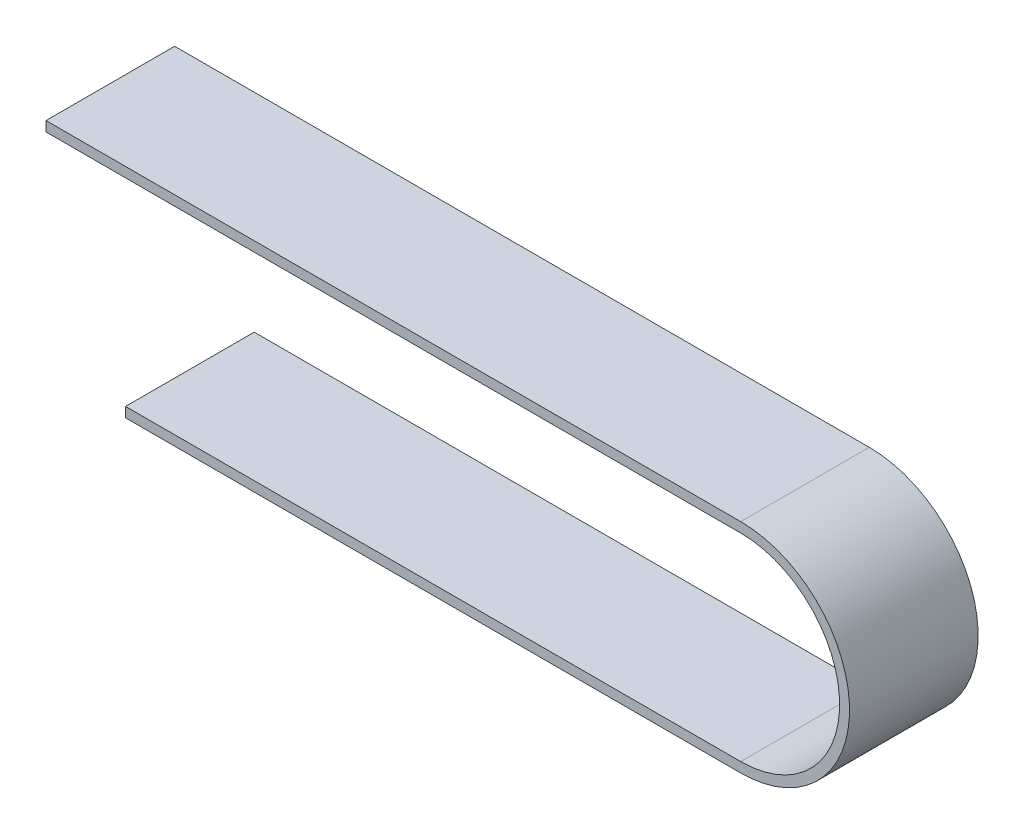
SolidWorks part; units mm, degrees
ref_plane "Plan de face" through (0, 0, 0) normal (0, 0, 1) x (1, 0, 0)
ref_plane "Plan de dessus" through (0, 0, 0) normal (0, 1, 0) x (1, 0, 0)
ref_plane "Plan de droite" through (0, 0, 0) normal (1, 0, 0) x (0, 0, -1)
sketch "Esquisse1" plane through (0, 0, 0) normal (0, 0, 1) x (1, 0, 0)
  line L1 (0, 110) -> (-702.0009, 110)
  line L3 (0, 100) -> (-702.0009, 100)
  line L4 (-702.0009, 110) -> (-702.0009, 100)
  line L5 (0, -110) -> (-621.6031, -110)
  line L7 (0, -100) -> (-621.6031, -100)
  line L8 (-621.6031, -110) -> (-621.6031, -100)
  arc A0 (0, -100) -> (0, 100) centre (0, 0) ccw
  arc A1 (0, -110) -> (0, 110) centre (0, 0) ccw
  dimension "D1" = 200
  dimension "D2" = 220
extrude "Extrusion1" add sketch "Esquisse1" along normal blind 130
